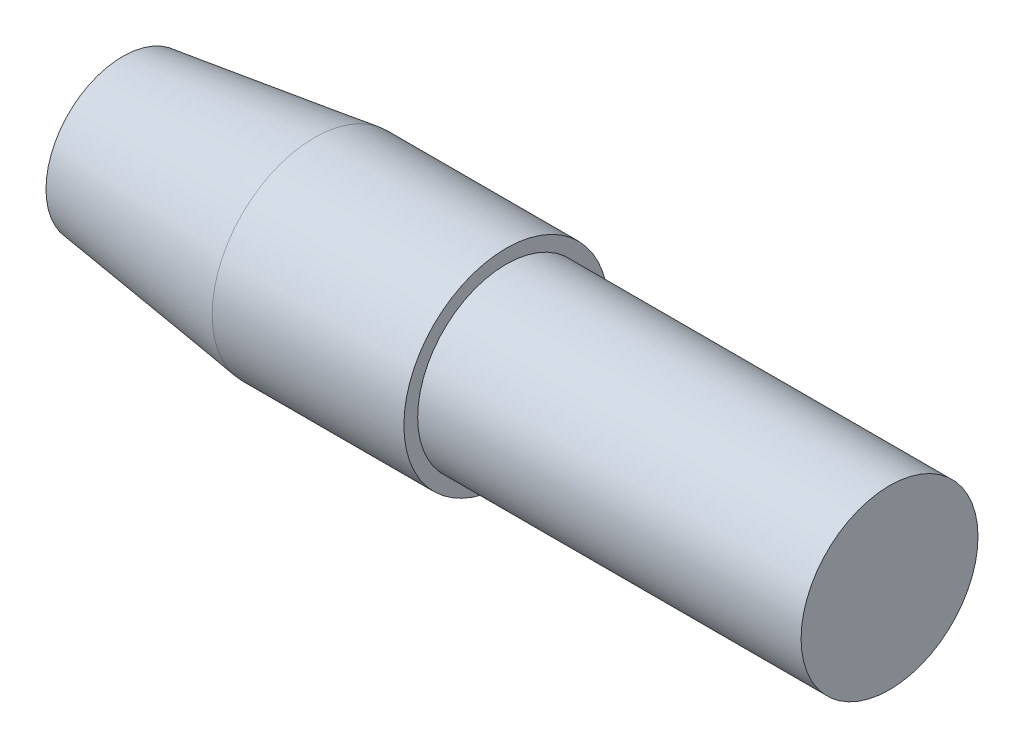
SolidWorks part; units mm, degrees
ref_plane "Vorne" through (0, 0, 0) normal (0, 0, 1) x (1, 0, 0)
ref_plane "Oben" through (0, 0, 0) normal (0, 1, 0) x (1, 0, 0)
ref_plane "Rechts" through (0, 0, 0) normal (1, 0, 0) x (0, 0, -1)
sketch "Skizze1" plane through (0, 0, 0) normal (0, 0, 1) x (1, 0, 0)
  line L0 (0, 0) -> (30, 0)
  line L1 (30, 3.4605) -> (15, 3.4605)
  line L2 (15, 3.4605) -> (15, 4)
  line L3 (15, 4) -> (7.5, 4)
  line L4 (7.5, 4) -> (0, 3)
  line L5 (0, 3) -> (0, 0)
  line L6 (30, 3.4605) -> (30, 0)
  dimension "D1" = 4
  dimension "D2" = 3.4605
  dimension "D3" = 30
  dimension "D4" = 7.5
  dimension "D5" = 7.5
  dimension "D6" = 3
revolve "Rotation1" add sketch "Skizze1" angle 360 about L0
